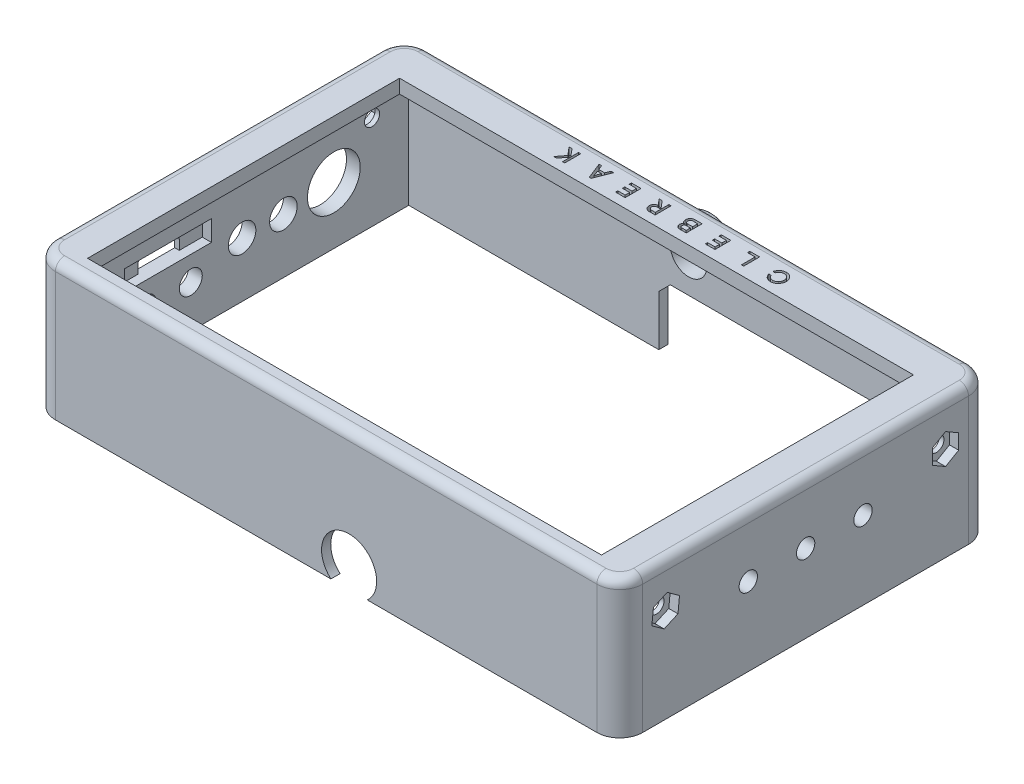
SolidWorks part; units mm, degrees
ref_plane "Plan de face" through (0, 0, 0) normal (0, 0, 1) x (1, 0, 0)
ref_plane "Plan de dessus" through (0, 0, 0) normal (0, 1, 0) x (1, 0, 0)
ref_plane "Plan de droite" through (0, 0, 0) normal (1, 0, 0) x (0, 0, -1)
sketch "Esquisse1" plane through (0, 0, 0) normal (0, 1, 0) x (1, 0, 0)
  line L1 (0, 0) -> (128, 0)
  line L2 (0, 0) -> (0, 81)
  line L3 (0, 81) -> (128, 81)
  line L4 (128, 0) -> (128, 81)
  dimension "D1" = 128
  dimension "D2" = 81
extrude "Boss.-Extru.1" add sketch "Esquisse1" along normal blind 3
sketch "Esquisse2" plane through (0, 0, 0) normal (0, -1, 0) x (1, 0, 0)
  line L0 (128, -81) -> (0, -81) construction
  line L1 (120, -4) -> (8, -4)
  line L2 (120, -4) -> (120, -72)
  line L3 (120, -72) -> (8, -72)
  line L4 (8, -4) -> (8, -72)
  line L5 (0, 0) -> (128, 0) construction
  line L6 (128, 0) -> (128, -81) construction
  line L7 (0, -81) -> (0, 0) construction
  dimension "D1" = 9
  dimension "D2" = 4
  dimension "D3" = 8
  dimension "D4" = 8
extrude "Enlèv. mat.-Extru.1" cut sketch "Esquisse2" against normal blind 3
sketch "Esquisse14" plane through (0, 0, 0) normal (0, -1, 0) x (1, 0, 0)
  line L0 (128, -81) -> (0, -81) construction
  line L1 (125, -2) -> (3, -2)
  line L2 (125, -2) -> (125, -79)
  line L3 (125, -79) -> (3, -79)
  line L4 (3, -2) -> (3, -79)
  line L5 (0, 0) -> (128, 0) construction
  line L6 (128, 0) -> (128, -81) construction
  line L7 (0, -81) -> (0, 0) construction
  line L9 (128, 0) -> (0, 0)
  line L10 (128, 0) -> (128, -81)
  line L11 (128, -81) -> (0, -81)
  line L12 (0, 0) -> (0, -81)
  dimension "D1" = 2
  dimension "D2" = 2
  dimension "D3" = 3
  dimension "D4" = 3
extrude "Boss.-Extru.3" add sketch "Esquisse14" along normal blind 27
fillet "Congé5" radius 2 4 edges at (128, 3, -40.5) (64, 3, 0) (0, 3, -40.5) (64, 3, -81)
sketch "Esquisse15" plane through (0, 3, 0) normal (0, 1, 0) x (1, 0, 0)
  line L0 (96, 77.5) -> (32, 77.5) construction
  line L1 (126, 79) -> (2, 79) construction
  line L2 (126, 2) -> (126, 79) construction
  line L3 (2, 79) -> (2, 2) construction
  text T0 "CLEBREAK" font "Code Bold" height 3.5
  dimension "D1" = 1.5
  dimension "D2" = 30
  dimension "D3" = 30
extrude "Enlèv. mat.-Extru.7" cut sketch "Esquisse15" against normal blind 1.5
sketch "Esquisse16" plane through (3, 0, 0) normal (1, 0, 0) x (0, 0, -1)
  line L0 (2, 0) -> (79, 0) construction
  line L1 (2, -27) -> (2, 0) construction
  circle A0 centre (10, -6.5) radius 1.65
  dimension "D1" = 3.3
  dimension "D2" = 6.5
  dimension "D3" = 8
extrude "Enlèv. mat.-Extru.8" cut sketch "Esquisse16" against normal through all both and the other way through all
sketch "Esquisse17" plane through (0, 0, 0) normal (-1, 0, 0) x (0, 0, 1)
  line L1 (-9.6631, -9.7828) -> (-6.9886, -7.8496)
  line L2 (-6.9886, -7.8496) -> (-7.3255, -4.5669)
  line L3 (-7.3255, -4.5669) -> (-10.3369, -3.2172)
  line L4 (-10.3369, -3.2172) -> (-13.0114, -5.1504)
  line L5 (-13.0114, -5.1504) -> (-12.6745, -8.4331)
  line L6 (-12.6745, -8.4331) -> (-9.6631, -9.7828)
  circle A0 centre (-10, -6.5) radius 2.8579 construction
  dimension "D1" = 6.6
extrude "Enlèv. mat.-Extru.9" cut sketch "Esquisse17" against normal blind 2
sketch "Esquisse18" plane through (128, 0, 0) normal (1, 0, 0) x (0, 0, -1)
  line L1 (9.6631, -9.7828) -> (12.6745, -8.4331)
  line L2 (12.6745, -8.4331) -> (13.0114, -5.1504)
  line L3 (13.0114, -5.1504) -> (10.3369, -3.2172)
  line L4 (10.3369, -3.2172) -> (7.3255, -4.5669)
  line L5 (7.3255, -4.5669) -> (6.9886, -7.8496)
  line L6 (6.9886, -7.8496) -> (9.6631, -9.7828)
  circle A0 centre (10, -6.5) radius 2.8579 construction
  dimension "D1" = 6.6
extrude "Enlèv. mat.-Extru.10" cut sketch "Esquisse18" against normal blind 2
sketch "Esquisse22" plane through (125, 0, 0) normal (-1, 0, 0) x (0, 0, 1)
  line L0 (-81, 1) -> (0, 1) construction
  line L2 (-2, -27) -> (-2, 0) construction
  circle A0 centre (-40.5, -10) radius 2
  circle A1 centre (-28, -10) radius 2
  circle A2 centre (-53, -10) radius 2
  dimension "D2" = 38.5
  dimension "D5" = 4
  dimension "D1" = 11
  dimension "D3" = 12.5
  dimension "D4" = 12.5
  dimension "D6" = 11
  dimension "D7" = 11
extrude "Enlèv. mat.-Extru.17" cut sketch "Esquisse22" against normal through all
sketch "Esquisse31" plane through (3, 0, 0) normal (1, 0, 0) x (0, 0, -1)
  line L0 (2, 0) -> (79, 0) construction
  line L1 (17, -12.5) -> (36, -12.5)
  line L2 (17, -12.5) -> (17, -8)
  line L3 (17, -8) -> (36, -8)
  line L4 (36, -12.5) -> (36, -8)
  line L5 (2, -27) -> (2, 0) construction
  dimension "D1" = 19
  dimension "D2" = 4.5
  dimension "D3" = 8
  dimension "D4" = 15
extrude "Enlèv. mat.-Extru.22" cut sketch "Esquisse31" against normal blind 2
sketch "Esquisse32" plane through (1, 0, 0) normal (1, 0, 0) x (0, 0, -1)
  line L0 (17, -12.5) -> (36, -12.5) construction
  line L1 (22, -9.5) -> (31, -9.5)
  line L2 (22, -9.5) -> (22, -12.5)
  line L3 (22, -12.5) -> (31, -12.5)
  line L4 (31, -9.5) -> (31, -12.5)
  line L5 (17, -8) -> (17, -12.5) construction
  dimension "D1" = 9
  dimension "D2" = 3
  dimension "D3" = 5
extrude "Enlèv. mat.-Extru.23" cut sketch "Esquisse32" against normal through all
sketch "Esquisse36" plane through (3, 0, 0) normal (1, 0, 0) x (0, 0, -1)
  line L0 (2, 0) -> (79, 0) construction
  circle A0 centre (62.6773, -14.5) radius 5.75
  dimension "D1" = 11.5
  dimension "D2" = 14.5
extrude "Enlèv. mat.-Extru.25" cut sketch "Esquisse36" against normal through all
sketch "Esquisse46" plane through (3, 0, 0) normal (1, 0, 0) x (0, 0, -1)
  line L0 (17, -8) -> (17, -12.5) construction
  line L1 (2, -27) -> (79, -27) construction
  circle A0 centre (21.5, -17.75) radius 2.5
  circle A1 centre (31.5, -17.75) radius 2.5
  dimension "D1" = 5
  dimension "D2" = 10
  dimension "D3" = 4.5
  dimension "D4" = 9.25
  dimension "D5" = 9.25
extrude "Enlèv. mat.-Extru.28" cut sketch "Esquisse46" against normal through all
fillet "Congé9" radius 1 2 edges at (0.5, -9.5, -31) (0.5, -9.5, -22)
sketch "Esquisse50" plane through (3, 0, 0) normal (1, 0, 0) x (0, 0, -1)
  line L0 (2, 0) -> (79, 0) construction
  circle A0 centre (42.6773, -15) radius 3
  circle A1 centre (51.6773, -15) radius 3
  circle A2 centre (62.6773, -14.5) radius 5.75 construction
  dimension "D1" = 6
  dimension "D5" = 11
  dimension "D2" = 15
  dimension "D3" = 15
  dimension "D4" = 9
extrude "Enlèv. mat.-Extru.29" cut sketch "Esquisse50" against normal through all
ref_plane "Plan2" through (0, -12.5, -22) normal (0, -1, 0) x (-1, 0, 0)
sketch "Esquisse63" plane through (125, 0, 0) normal (-1, 0, 0) x (0, 0, 1)
  line L0 (-32.0954, -13.5) -> (-43.7424, -13.5) construction
  circle A0 centre (-28, -10) radius 2 construction
  dimension "D1" = 3.5
sketch "Esquisse65" plane through (0, 0, -2) normal (0, 0, -1) x (-1, 0, 0)
  line L0 (-125, -27) -> (-125, 0) construction
  line L1 (-125, -27) -> (-3, -27) construction
  circle A0 centre (-69, -22.5) radius 6
  dimension "D2" = 12
  dimension "D1" = 56
  dimension "D3" = 4.5
extrude "Enlèv. mat.-Extru.33" cut sketch "Esquisse65" against normal up to next
fillet "Congé11" radius 5 8 edges at (127.4142, 2.4142, -0.5858) (127.4142, 2.4142, -80.4142) (0.5858, 2.4142, -80.4142) (0.5858, 2.4142, -0.5858) (0, -13, 0) (0, -13, -81) (128, -13, -81) (128, -13, 0)
sketch "Esquisse66" plane through (0, 0, -81) normal (0, 0, -1) x (-1, 0, 0)
  line L0 (-5, -27) -> (-123, -27) construction
  line L1 (-57.5, -27) -> (-125, -27)
  line L2 (-57.5, -27) -> (-57.5, -13.5)
  line L3 (-57.5, -13.5) -> (-125, -13.5)
  line L4 (-125, -27) -> (-125, -13.5)
  line L5 (-123, 1) -> (-123, -27) construction
  dimension "D1" = 13.5
  dimension "D2" = 67.5
  dimension "D3" = 2
extrude "Enlèv. mat.-Extru.34" cut sketch "Esquisse66" against normal up to next
chamfer "Chanfrein2" distance 2.5 angle 45 2 edges at (125, -13.5, -79.7913) (57.5, -13.5, -80)
sketch "Esquisse72" plane through (0, 0, -2) normal (0, 0, -1) x (-1, 0, 0)
  line L0 (-125, -27) -> (-72.9686, -27) construction
  line L1 (-116.25, -13.5) -> (-66.25, -13.5)
  line L2 (-116.25, -13.5) -> (-116.25, -10.5)
  line L3 (-116.25, -10.5) -> (-66.25, -10.5)
  line L4 (-66.25, -13.5) -> (-66.25, -10.5)
  line L5 (-125, -27) -> (-125, 0) construction
  dimension "D1" = 13.5
  dimension "D2" = 50
  dimension "D3" = 3
  dimension "D4" = 8.75
extrude "Boss.-Extru.5" add sketch "Esquisse72" along normal blind 3
fillet "Congé12" radius 3 1 edges at (91.25, -10.5, -2)
fillet "Congé13" radius 1 1 edges at (91.25, -10.5, -5)
sketch "Esquisse80" plane through (0, 0, -79) normal (0, 0, 1) x (1, 0, 0)
  line L0 (5, -27) -> (5, 1) construction
  line L2 (5, 1) -> (123, 1) construction
  circle A0 centre (64, -6) radius 6
  dimension "D1" = 59
  dimension "D2" = 12
  dimension "D3" = 7
extrude "Boss.-Extru.7" add sketch "Esquisse80" against normal blind 5
sketch "Esquisse81" plane through (0, 0, -84) normal (0, 0, -1) x (-1, 0, 0)
  circle A0 centre (-64, -6) radius 4
  circle A1 centre (-64, -6) radius 6 construction
  dimension "D1" = 8
extrude "Enlèv. mat.-Extru.36" cut sketch "Esquisse81" against normal up to next
fillet "Congé16" radius 1 2 edges at (70, -6, -84) (70, -6, -81)
sketch "Esquisse82" plane through (3, 0, 0) normal (1, 0, 0) x (0, 0, -1)
  line L0 (79, -27) -> (79, 0) construction
  line L1 (2, 0) -> (79, 0) construction
  circle A0 centre (71, -6.5) radius 1.65
  dimension "D3" = 3.3
  dimension "D1" = 8
  dimension "D2" = 6.5
extrude "Enlèv. mat.-Extru.37" cut sketch "Esquisse82" against normal through all both and the other way through all
sketch "Esquisse83" plane through (0, 0, 0) normal (-1, 0, 0) x (0, 0, 1)
  line L1 (-71, -9.8) -> (-68.1421, -8.15)
  line L2 (-68.1421, -8.15) -> (-68.1421, -4.85)
  line L3 (-68.1421, -4.85) -> (-71, -3.2)
  line L4 (-71, -3.2) -> (-73.8579, -4.85)
  line L5 (-73.8579, -4.85) -> (-73.8579, -8.15)
  line L6 (-73.8579, -8.15) -> (-71, -9.8)
  circle A0 centre (-71, -6.5) radius 2.8579 construction
  dimension "D1" = 6.6
extrude "Enlèv. mat.-Extru.38" cut sketch "Esquisse83" against normal blind 2
sketch "Esquisse84" plane through (128, 0, 0) normal (1, 0, 0) x (0, 0, -1)
  line L1 (71, -9.8) -> (73.8579, -8.15)
  line L2 (73.8579, -8.15) -> (73.8579, -4.85)
  line L3 (73.8579, -4.85) -> (71, -3.2)
  line L4 (71, -3.2) -> (68.1421, -4.85)
  line L5 (68.1421, -4.85) -> (68.1421, -8.15)
  line L6 (68.1421, -8.15) -> (71, -9.8)
  circle A0 centre (71, -6.5) radius 2.8579 construction
  dimension "D1" = 6.6
extrude "Enlèv. mat.-Extru.39" cut sketch "Esquisse84" against normal blind 2
